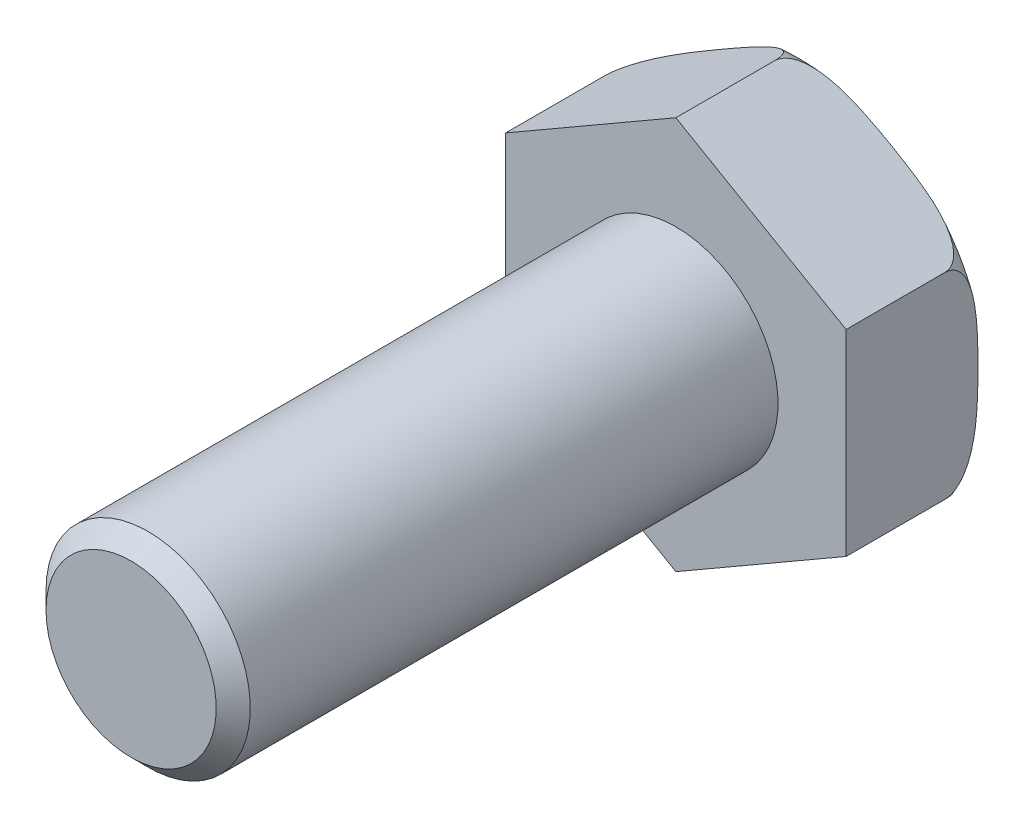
SolidWorks part; units mm, degrees
ref_plane "Plan1" through (0, 0, 0) normal (0, 0, 1) x (1, 0, 0)
ref_plane "Plan2" through (0, 0, 0) normal (0, 1, 0) x (1, 0, 0)
ref_plane "Plan3" through (0, 0, 0) normal (1, 0, 0) x (0, 0, -1)
sketch "profil tête" plane through (0, 0, 0) normal (0, 0, 1) x (1, 0, 0)
  line L0 (0, 5.7735) -> (0, -5.7735) construction
  line L2 (-5, 2.8868) -> (-5, -2.8868)
  line L3 (5, 2.8868) -> (5, -2.8868)
  line L4 (-5, 2.8868) -> (0, 5.7735)
  line L5 (5, 2.8868) -> (0, 5.7735)
  line L6 (-5, -2.8868) -> (0, -5.7735)
  line L7 (5, -2.8868) -> (0, -5.7735)
  line L8 (-5, -2.8868) -> (5, 2.8868) construction
  line L9 (-5, 2.8868) -> (5, -2.8868) construction
  dimension "D1" = 60
  dimension "DIAMETRE" = 10
extrude "TETE" add sketch "profil tête" along normal blind 3.9
sketch "profil congé" plane through (0, 0, 0) normal (1, 0, 0) x (0, 0, -1)
  line L0 (-1, 5.7735) -> (0, 5.7735)
  line L2 (0, 2.8868) -> (0, 5.7735) construction
  line L3 (0, 5.7735) -> (0, 4.7735)
  line L4 (0, 0) -> (0.4797, 0) construction
  line L5 (-3.9, 5.7735) -> (0, 5.7735) construction
  arc A0 (-1, 5.7735) -> (0, 4.7735) centre (-1, 4.7735) cw
  dimension "D1" = 1
revolve "CONGE" cut sketch "profil congé" angle 360 about L4
sketch "profil cylindre" plane through (0, 0, 3.9) normal (0, 0, 1) x (1, 0, 0)
  circle A0 centre (0, 0) radius 3
  dimension "DIAMETRE" = 6
extrude "CYLINDRE FILETE" add sketch "profil cylindre" along normal blind 16
revolve "CHANFREIN FILET" cut sketch "profil chanfrein" angle 360 about L4
sketch "profil chanfrein" plane through (0, 0, 0) normal (1, 0, 0) x (0, 0, -1)
  line L0 (-19.9, 2.5) -> (-19.4, 3)
  line L1 (-19.9, 3) -> (-19.9, -3) construction
  line L2 (-19.9, 3) -> (-19.4, 3)
  line L3 (-3.9, 3) -> (-19.9, 3) construction
  line L4 (-12.0874, 0) -> (-18.1046, 0) construction
  line L5 (-19.9, 0) -> (-3.9, 0) construction
  line L8 (-19.9, 3) -> (-19.9, 2.5)
  dimension "D2" = 5
  dimension "D3" = 45
equation "\"D2@profil chanfrein\" = \"DIAMETRE FOND FILET@Représentation de filetage1\""
